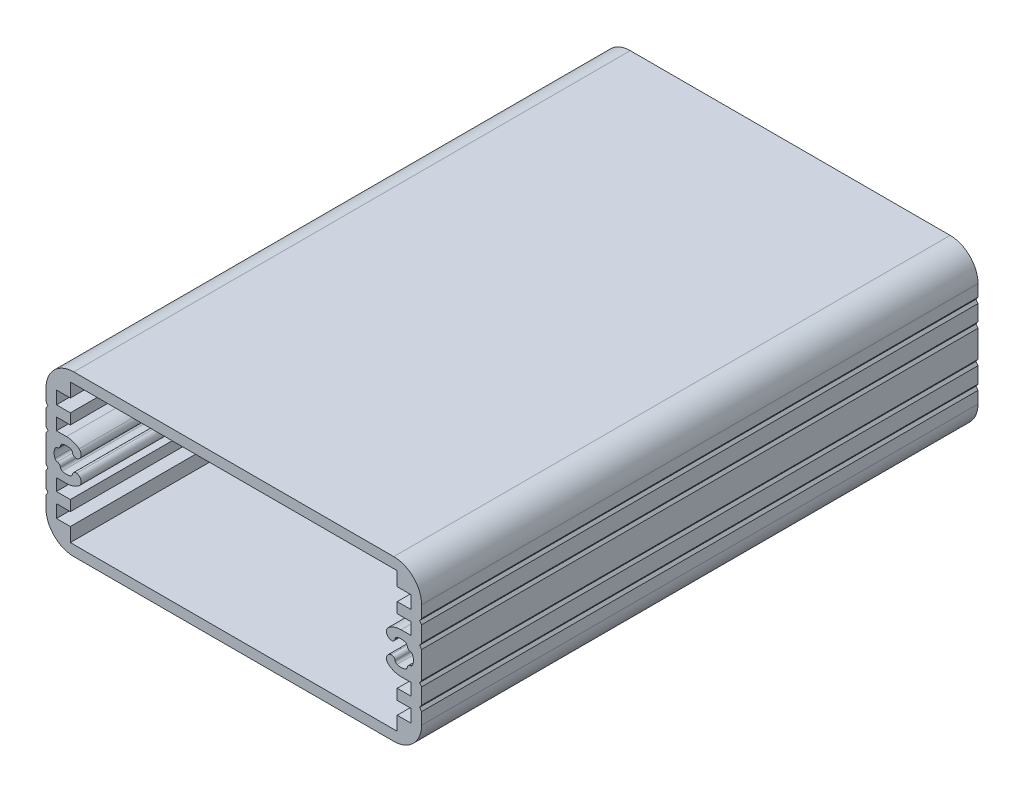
SolidWorks part; units mm, degrees
ref_plane "Front Plane" through (0, 0, 0) normal (0, 0, 1) x (1, 0, 0)
ref_plane "Top Plane" through (0, 0, 0) normal (0, 1, 0) x (1, 0, 0)
ref_plane "Right Plane" through (0, 0, 0) normal (1, 0, 0) x (0, 0, -1)
ref_plane "Plane1" through (0, 0, 40) normal (0, 0, 1) x (1, 0, 0)
sketch "Sketch1" plane through (0, 0, 40) normal (0, 0, 1) x (1, 0, 0)
  line L0 (-24.05, 2.92) -> (-25.5, 2.92)
  line L1 (-25.5, 2.92) -> (-25.5, 4.64)
  line L2 (-25.5, 4.64) -> (-23.5, 4.64)
  line L3 (-23.5, 4.64) -> (-23.5, 6.15)
  line L4 (-23.5, 6.15) -> (-25.5, 6.15)
  line L5 (-25.5, 6.15) -> (-25.5, 8)
  line L6 (-25.5, 8) -> (-23.5, 8)
  line L7 (-23.5, 8) -> (-23.5, 10)
  line L8 (-23.5, 10) -> (23.5, 10)
  line L9 (23.5, 10) -> (23.5, 8)
  line L10 (23.5, 8) -> (25.5, 8)
  line L11 (25.5, 8) -> (25.5, 6.15)
  line L12 (25.5, 6.15) -> (23.5, 6.15)
  line L13 (23.5, 6.15) -> (23.5, 4.64)
  line L14 (23.5, 4.64) -> (25.5, 4.64)
  line L15 (25.5, 4.64) -> (25.5, 2.92)
  line L16 (25.5, 2.92) -> (24.05, 2.92)
  line L17 (24.05, -2.92) -> (25.5, -2.92)
  line L18 (25.5, -2.92) -> (25.5, -4.64)
  line L19 (25.5, -4.64) -> (23.5, -4.64)
  line L20 (23.5, -4.64) -> (23.5, -6.15)
  line L21 (23.5, -6.15) -> (25.5, -6.15)
  line L22 (25.5, -6.15) -> (25.5, -8)
  line L23 (25.5, -8) -> (23.5, -8)
  line L24 (23.5, -8) -> (23.5, -10)
  line L25 (23.5, -10) -> (-23.5, -10)
  line L26 (-23.5, -10) -> (-23.5, -8)
  line L27 (-23.5, -8) -> (-25.5, -8)
  line L28 (-25.5, -8) -> (-25.5, -6.15)
  line L29 (-25.5, -6.15) -> (-23.5, -6.15)
  line L30 (-23.5, -6.15) -> (-23.5, -4.64)
  line L31 (-23.5, -4.64) -> (-25.5, -4.64)
  line L32 (-25.5, -4.64) -> (-25.5, -2.92)
  line L33 (-25.5, -2.92) -> (-24.05, -2.92)
  line L34 (27, 5.7977) -> (27, 7.5)
  line L35 (23, 11.5) -> (-23, 11.5)
  line L36 (-27, 7.5) -> (-27, 5.7977)
  line L37 (-27, 5.7977) -> (-26.7206, 5.404)
  line L38 (-26.7206, 5.404) -> (-27, 5.0103)
  line L39 (-27, 5.0103) -> (-27, 2.7243)
  line L40 (-27, 2.7243) -> (-26.7206, 2.3306)
  line L41 (-26.7206, 2.3306) -> (-27, 1.9369)
  line L42 (-27, 1.9369) -> (-27, -1.9369)
  line L43 (-27, -1.9369) -> (-26.7206, -2.3306)
  line L44 (-26.7206, -2.3306) -> (-27, -2.7243)
  line L45 (-27, -2.7243) -> (-27, -5.0103)
  line L46 (-27, -5.0103) -> (-26.7206, -5.404)
  line L47 (-26.7206, -5.404) -> (-27, -5.7977)
  line L48 (-27, -5.7977) -> (-27, -7.5)
  line L49 (-23, -11.5) -> (23, -11.5)
  line L50 (27, -7.5) -> (27, -5.7977)
  line L51 (27, -5.7977) -> (26.7206, -5.404)
  line L52 (26.7206, -5.404) -> (27, -5.0103)
  line L53 (27, -5.0103) -> (27, -2.7243)
  line L54 (27, -2.7243) -> (26.7206, -2.3306)
  line L55 (26.7206, -2.3306) -> (27, -1.9369)
  line L56 (27, -1.9369) -> (27, 1.9369)
  line L57 (27, 1.9369) -> (26.7206, 2.3306)
  line L58 (26.7206, 2.3306) -> (27, 2.7243)
  line L59 (27, 2.7243) -> (27, 5.0103)
  line L60 (27, 5.0103) -> (26.7206, 5.404)
  line L61 (26.7206, 5.404) -> (27, 5.7977)
  arc A0 (-24.6582, 1.6729) -> (-23.4685, 1.6824) centre (-24.05, 0) cw
  arc A1 (-23.4685, 1.6824) -> (-23.1837, 1.3396) centre (-23.609, 1.2759) cw
  arc A2 (-23.1837, 1.3396) -> (-22.5919, 0.9126) centre (-22.6794, 1.415) ccw
  arc A3 (-22.5919, 0.9126) -> (-22.243, 2.2937) centre (-22.7257, 1.681) ccw
  arc A4 (-22.243, 2.2937) -> (-24.05, 2.92) centre (-24.05, 0) ccw
  arc A5 (24.05, 2.92) -> (22.243, 2.2937) centre (24.05, 0) ccw
  arc A6 (22.243, 2.2937) -> (22.5919, 0.9126) centre (22.7257, 1.681) ccw
  arc A7 (22.5919, 0.9126) -> (23.1837, 1.3396) centre (22.6794, 1.415) ccw
  arc A8 (23.1837, 1.3396) -> (23.4685, 1.6824) centre (23.609, 1.2759) cw
  arc A9 (23.4685, 1.6824) -> (24.6582, 1.6729) centre (24.05, 0) cw
  arc A10 (24.6582, 1.6729) -> (24.9375, 1.3256) centre (24.5112, 1.2688) cw
  arc A11 (24.9375, 1.3256) -> (25.3756, 0.8875) centre (25.443, 1.393) ccw
  arc A12 (25.3756, 0.8875) -> (25.7229, 0.6082) centre (25.3188, 0.4612) cw
  arc A13 (25.7229, 0.6082) -> (25.7229, -0.6082) centre (24.05, 0) cw
  arc A14 (25.7229, -0.6082) -> (25.3756, -0.8875) centre (25.3188, -0.4612) cw
  arc A15 (25.3756, -0.8875) -> (24.9375, -1.3256) centre (25.443, -1.393) ccw
  arc A16 (24.9375, -1.3256) -> (24.6582, -1.6729) centre (24.5112, -1.2688) cw
  arc A17 (24.6582, -1.6729) -> (23.4685, -1.6824) centre (24.05, 0) cw
  arc A18 (23.4685, -1.6824) -> (23.1837, -1.3396) centre (23.609, -1.2759) cw
  arc A19 (23.1837, -1.3396) -> (22.5919, -0.9126) centre (22.6794, -1.415) ccw
  arc A20 (22.5919, -0.9126) -> (22.243, -2.2937) centre (22.7257, -1.681) ccw
  arc A21 (22.243, -2.2937) -> (24.05, -2.92) centre (24.05, 0) ccw
  arc A22 (-24.05, -2.92) -> (-22.243, -2.2937) centre (-24.05, 0) ccw
  arc A23 (-22.243, -2.2937) -> (-22.5919, -0.9126) centre (-22.7257, -1.681) ccw
  arc A24 (-22.5919, -0.9126) -> (-23.1837, -1.3396) centre (-22.6794, -1.415) ccw
  arc A25 (-23.1837, -1.3396) -> (-23.4685, -1.6824) centre (-23.609, -1.2759) cw
  arc A26 (-23.4685, -1.6824) -> (-24.6582, -1.6729) centre (-24.05, 0) cw
  arc A27 (-24.6582, -1.6729) -> (-24.9375, -1.3256) centre (-24.5112, -1.2688) cw
  arc A28 (-24.9375, -1.3256) -> (-25.3756, -0.8875) centre (-25.443, -1.393) ccw
  arc A29 (-25.3756, -0.8875) -> (-25.7229, -0.6082) centre (-25.3188, -0.4612) cw
  arc A30 (-25.7229, -0.6082) -> (-25.7229, 0.6082) centre (-24.05, 0) cw
  arc A31 (-25.7229, 0.6082) -> (-25.3756, 0.8875) centre (-25.3188, 0.4612) cw
  arc A32 (-25.3756, 0.8875) -> (-24.9375, 1.3256) centre (-25.443, 1.393) ccw
  arc A33 (-24.9375, 1.3256) -> (-24.6582, 1.6729) centre (-24.5112, 1.2688) cw
  arc A34 (27, 7.5) -> (23, 11.5) centre (23, 7.5) ccw
  arc A35 (-23, 11.5) -> (-27, 7.5) centre (-23, 7.5) ccw
  arc A36 (-27, -7.5) -> (-23, -11.5) centre (-23, -7.5) ccw
  arc A37 (23, -11.5) -> (27, -7.5) centre (23, -7.5) ccw
extrude "Boss-Extrude1" add sketch "Sketch1" against normal blind 80
